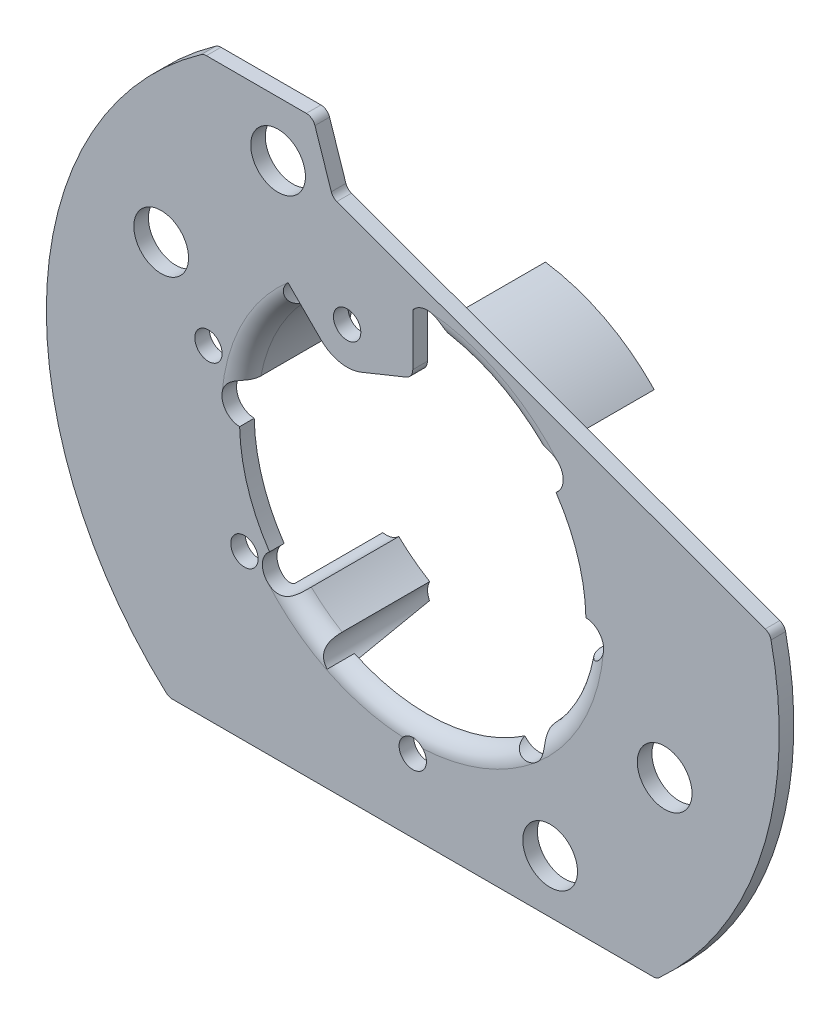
SolidWorks part; units mm, degrees
ref_plane "Face" through (0, 0, 0) normal (0, 0, 1) x (1, 0, 0)
ref_plane "Dessus" through (0, 0, 0) normal (0, 1, 0) x (1, 0, 0)
ref_plane "Droite" through (0, 0, 0) normal (1, 0, 0) x (0, 0, -1)
sketch "Esquisse1" plane through (0, 0, 0) normal (0, 0, 1) x (1, 0, 0)
  line L0 (-11.6124, 443.7209) -> (350.4487, 443.7209) construction
  line L1 (-25, 0) -> (25, 0) construction
  line L2 (-13.3795, -15) -> (13.3795, -15)
  line L3 (-11.4787, 16.5) -> (-5.4787, 16.5)
  line L4 (-5.4787, 16.5) -> (-4.3925, 13.2288)
  line L5 (-4.3925, 13.2288) -> (19.5898, 4.5)
  line L6 (0, 9.5) -> (0, 7.2438)
  line L7 (-0.3605, 6.7088) -> (-2.8367, 5.7056)
  line L8 (-5.0373, 6.1522) -> (-6.1369, 7.2518)
  line L9 (-3.9869, -8.6229) -> (-1.6409, -6.2769)
  circle A0 centre (0, 0) radius 20.1 construction
  circle A1 centre (13.8157, -5.2319) radius 1.5
  arc A2 (-11.4787, 16.5) -> (-13.3795, -15) centre (0, 0) ccw
  circle A3 centre (7.5344, -12.0806) radius 1.5
  circle A5 centre (-13.8005, 6.4042) radius 1.5
  arc A7 (13.3795, -15) -> (19.5898, 4.5) centre (0, 0) ccw
  circle A8 centre (-7.3883, 13.4724) radius 1.5
  arc A11 (-6.1369, 7.2518) -> (-3.9869, -8.6229) centre (0, 0) ccw
  arc A12 (0, 7.2438) -> (-0.3605, 6.7088) centre (-0.5772, 7.2438) cw
  arc A13 (-2.8367, 5.7056) -> (-5.0373, 6.1522) centre (-3.6, 7.5895) cw
  arc A14 (-1.6409, -6.2769) -> (4.3103, -8.4659) centre (0, -11) cw
  arc A15 (4.3103, -8.4659) -> (0, 9.5) centre (0, 0) ccw
  dimension "D7" = 3
  dimension "D8" = 19
  dimension "D10" = 5
  dimension "D1" = 50
  dimension "D2" = 20
  dimension "D3" = 6
  dimension "D4" = 16.5
  dimension "D5" = 15
  dimension "D6" = 4.5
  dimension "D9" = 45
  dimension "D11" = 4.5
extrude "Boss.-Extru.1" add sketch "Esquisse1" along normal blind 0.8
fillet "Congé1" radius 0.5 6 edges at (-13.3795, -15, 0.4) (13.3795, -15, 0.4) (19.5898, 4.5, 0.4) (-11.4787, 16.5, 0.4) (-4.3925, 13.2288, 0.4) (-5.4787, 16.5, 0.4)
sketch "Esquisse4" plane through (0, 0, 0.8) normal (0, 0, 1) x (1, 0, 0)
  circle A0 centre (-3.6, 7.5895) radius 0.75
  circle A1 centre (-11.2076, 2.7807) radius 0.75
  circle A2 centre (-9.2331, -6) radius 0.75
  circle A3 centre (0, -11) radius 0.75
  dimension "D1" = 1.5
extrude "Enlèv. mat.-Extru.1" cut sketch "Esquisse4" against normal through all
sketch "Esquisse5" plane through (0, 0, 0.8) normal (0, 0, 1) x (1, 0, 0)
  line L0 (0, 0) -> (-6.1369, 7.2518) construction
  line L1 (0, 0) -> (0.7883, 9.4672) construction
  line L2 (0, 0) -> (7.2518, 6.1369) construction
  line L3 (0, 0) -> (9.4672, -0.7883) construction
  line L4 (0, 0) -> (6.1369, -7.2518) construction
  line L5 (0, 0) -> (-0.7883, -9.4672) construction
  line L6 (0, 0) -> (-7.2518, -6.1369) construction
  line L7 (0, 0) -> (-9.4672, 0.7883) construction
  line L8 (-6.1369, 7.2518) -> (-6.844, 7.9589)
  line L10 (-5.0373, 6.1522) -> (-6.1369, 7.2518) construction
  line L11 (-3.9869, -8.6229) -> (-4.694, -9.33)
  line L12 (-3.9869, -8.6229) -> (-1.6409, -6.2769) construction
  line L13 (0, 9.5) -> (0, 10.0825)
  arc A0 (-9.4977, -0.2112) -> (-9.3319, 1.7791) centre (-9.4672, 0.7883) cw
  arc A1 (-6.1369, 7.2518) -> (-3.9869, -8.6229) centre (0, 0) ccw construction
  arc A2 (-6.5665, -6.8652) -> (-7.8567, -5.3406) centre (-7.2518, -6.1369) cw
  arc A3 (6.8652, -6.5665) -> (5.3406, -7.8567) centre (6.1369, -7.2518) cw
  arc A4 (4.3103, -8.4659) -> (0, 9.5) centre (0, 0) ccw construction
  arc A5 (9.4977, 0.2112) -> (9.3319, -1.7791) centre (9.4672, -0.7883) cw
  arc A6 (6.5665, 6.8652) -> (7.8567, 5.3406) centre (7.2518, 6.1369) cw
  arc A7 (-6.8652, 6.5665) -> (-6.844, 7.9589) centre (-6.1369, 7.2518) cw
  arc A8 (-6.8652, 6.5665) -> (-6.1369, 7.2518) centre (0, 0) cw
  arc A9 (5.3406, -7.8567) -> (6.8652, -6.5665) centre (0, 0) ccw
  arc A10 (7.8567, 5.3406) -> (6.5665, 6.8652) centre (0, 0) ccw
  arc A11 (9.3319, -1.7791) -> (9.4977, 0.2112) centre (0, 0) ccw
  arc A12 (-7.8567, -5.3406) -> (-6.5665, -6.8652) centre (0, 0) ccw
  arc A13 (-9.3319, 1.7791) -> (-9.4977, -0.2112) centre (0, 0) ccw
  arc A14 (-3.9869, -8.6229) -> (-4.8712, -8.1561) centre (0, 0) cw
  arc A15 (-4.694, -9.33) -> (-4.8712, -8.1561) centre (-3.9869, -8.6229) cw
  arc A16 (1.7791, 9.3319) -> (0, 10.0825) centre (0.7883, 9.4672) ccw
  arc A17 (0, 9.5) -> (1.7791, 9.3319) centre (0, 0) cw
  point P15 (0, 0)
  dimension "D2" = 1
  dimension "D1" = 8
extrude "Enlèv. mat.-Extru.2" cut sketch "Esquisse5" against normal through all
sketch "Esquisse6" plane through (0, 0, 0) normal (0, 0, -1) x (-1, 0, 0)
  arc A0 (4.8712, -8.1561) -> (6.5665, -6.8652) centre (0, 0) ccw construction
  arc A1 (9.3319, 1.7791) -> (6.8652, 6.5665) centre (0, 0) ccw construction
  arc A2 (-9.3319, -1.7791) -> (-6.8652, -6.5665) centre (0, 0) ccw construction
  arc A3 (-1.7791, 9.3319) -> (-6.5665, 6.8652) centre (0, 0) ccw construction
  arc A4 (4.8712, -8.1561) -> (6.5665, -6.8652) centre (0, 0) ccw
  arc A5 (9.3319, 1.7791) -> (6.8652, 6.5665) centre (0, 0) ccw
  arc A6 (-9.3319, -1.7791) -> (-6.8652, -6.5665) centre (0, 0) ccw
  arc A7 (-1.7791, 9.3319) -> (-6.5665, 6.8652) centre (0, 0) ccw
  arc A8 (-1.4755, 10.1938) -> (-7.4446, 7.1181) centre (0, 0) ccw
  arc A9 (-10.1938, -1.4755) -> (-7.1181, -7.4446) centre (0, 0) ccw
  arc A10 (4.8815, -9.0698) -> (7.4446, -7.1181) centre (0, 0) ccw
  arc A11 (10.1938, 1.4755) -> (7.1181, 7.4446) centre (0, 0) ccw
  arc A12 (0, 10.0825) -> (-1.7791, 9.3319) centre (-0.7883, 9.4672) ccw construction
  arc A13 (-6.5665, 6.8652) -> (-7.8567, 5.3406) centre (-7.2518, 6.1369) ccw construction
  arc A14 (-1.4755, 10.1938) -> (-1.7791, 9.3319) centre (-0.7883, 9.4672) ccw
  arc A15 (-6.5665, 6.8652) -> (-7.4446, 7.1181) centre (-7.2518, 6.1369) ccw
  arc A16 (-1.929, 10.1178) -> (-7.1195, 7.4433) centre (0, 0) ccw construction
  arc A18 (9.4977, -0.2112) -> (9.3319, 1.7791) centre (9.4672, 0.7883) ccw construction
  arc A19 (6.8652, 6.5665) -> (6.844, 7.9589) centre (6.1369, 7.2518) ccw construction
  arc A20 (10.1938, 1.4755) -> (9.3319, 1.7791) centre (9.4672, 0.7883) ccw
  arc A21 (6.8652, 6.5665) -> (7.1181, 7.4446) centre (6.1369, 7.2518) ccw
  arc A22 (10.1178, 1.929) -> (7.4433, 7.1195) centre (0, 0) ccw construction
  arc A25 (4.694, -9.33) -> (4.8712, -8.1561) centre (3.9869, -8.6229) ccw construction
  arc A26 (6.5665, -6.8652) -> (7.8567, -5.3406) centre (7.2518, -6.1369) ccw construction
  arc A27 (4.8815, -9.0698) -> (4.8712, -8.1561) centre (3.9869, -8.6229) ccw
  arc A28 (6.5665, -6.8652) -> (7.4446, -7.1181) centre (7.2518, -6.1369) ccw
  arc A37 (-9.4977, 0.2112) -> (-9.3319, -1.7791) centre (-9.4672, -0.7883) ccw construction
  arc A38 (-6.8652, -6.5665) -> (-5.3406, -7.8567) centre (-6.1369, -7.2518) ccw construction
  arc A39 (-10.1938, -1.4755) -> (-9.3319, -1.7791) centre (-9.4672, -0.7883) ccw
  arc A40 (-6.8652, -6.5665) -> (-7.1181, -7.4446) centre (-6.1369, -7.2518) ccw
  arc A41 (-10.1178, -1.929) -> (-7.4433, -7.1195) centre (0, 0) ccw construction
  dimension "D2" = 0.8
  dimension "D1" = 0.8
extrude "Boss.-Extru.2" add sketch "Esquisse6" along normal blind 5
fillet "Congé2" radius 1 4 edges at (-5.7552, -7.5583, 0.8) (-8.4449, 4.3513, 0.8) (8.4449, -4.3513, 0.8) (4.3513, 8.4449, 0.8)
fillet "Congé3" radius 0.2 4 edges at (-9.156, 4.7177, 0) (-6.2398, -8.1948, 0) (4.7177, 9.156, 0) (9.156, -4.7177, 0)
